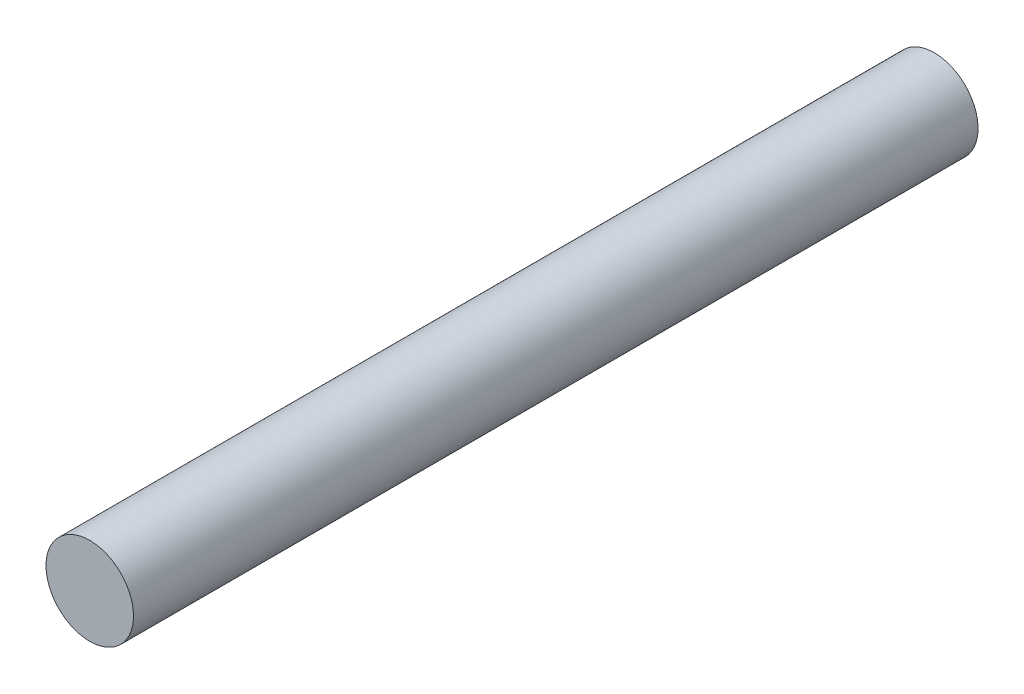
SolidWorks part; units mm, degrees
ref_plane "Front Plane" through (0, 0, 0) normal (0, 0, 1) x (1, 0, 0)
ref_plane "Top Plane" through (0, 0, 0) normal (0, 1, 0) x (1, 0, 0)
ref_plane "Right Plane" through (0, 0, 0) normal (1, 0, 0) x (0, 0, -1)
sketch "Sketch1" plane through (0, 0, 0) normal (0, 0, 1) x (1, 0, 0)
  circle A0 centre (0, 0) radius 3.15
  dimension "D1" = 6.3
extrude "Boss-Extrude1" add sketch "Sketch1" along normal mid plane 60.8
